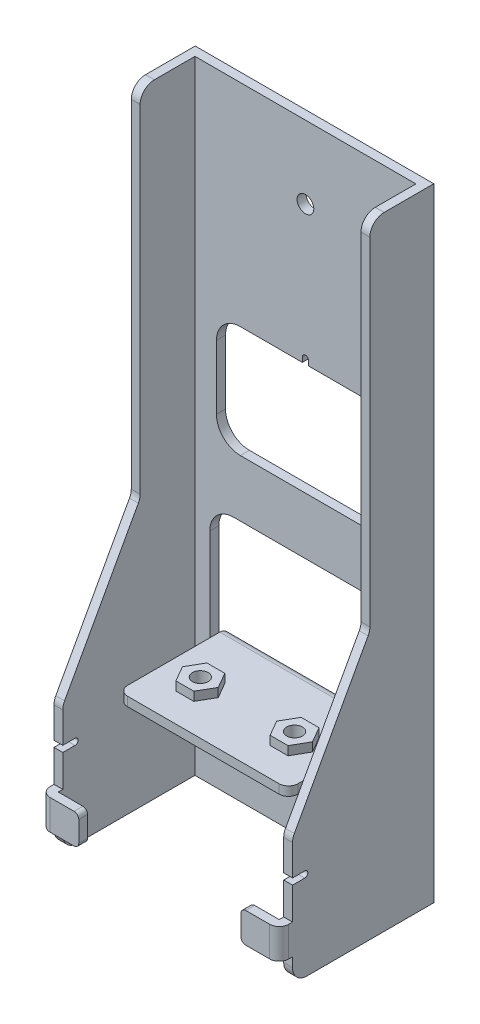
SolidWorks part; units mm, degrees
ref_plane "Plan de face" through (0, 0, 0) normal (0, 0, 1) x (1, 0, 0)
ref_plane "Plan de dessus" through (0, 0, 0) normal (0, 1, 0) x (1, 0, 0)
ref_plane "Plan de droite" through (0, 0, 0) normal (1, 0, 0) x (0, 0, -1)
sketch "Esquisse1" plane through (0, 0, 0) normal (0, 0, 1) x (1, 0, 0)
  line L0 (25, 0) -> (2.5, 0)
  line L1 (-25, 0) -> (-25, 130.5)
  line L2 (-25, 130.5) -> (25, 130.5)
  line L3 (25, 130.5) -> (25, 0)
  line L4 (-2.5, 2.8) -> (-2.5, 0)
  line L5 (2.5, 2.8) -> (2.5, 0)
  line L6 (-2.5, 0) -> (-25, 0)
  line L7 (-17.85, 26) -> (-17.85, 28.7)
  line L8 (-15.05, 50.9) -> (15.05, 50.9)
  line L9 (-20.05, 45.9) -> (-20.05, 26)
  line L10 (-17.85, 28.7) -> (17.85, 28.7)
  line L11 (20.05, 45.9) -> (20.05, 26)
  line L12 (-13.65, 86.2) -> (-0.65, 86.2)
  line L13 (-18.65, 81.2) -> (-18.65, 67.8)
  line L14 (-13.65, 62.8) -> (13.65, 62.8)
  line L15 (18.65, 81.2) -> (18.65, 67.8)
  line L16 (17.85, 26) -> (17.85, 28.7)
  line L17 (-0.65, 87.2) -> (-0.65, 86.2)
  line L18 (0.65, 87.2) -> (0.65, 86.2)
  line L19 (0.65, 86.2) -> (13.65, 86.2)
  arc A0 (2.5, 2.8) -> (-2.5, 2.8) centre (0, 2.8) ccw
  circle A1 centre (-18.05, 18.95) radius 1.75
  circle A2 centre (18.05, 18.95) radius 1.75
  arc A3 (-18.65, 67.8) -> (-13.65, 62.8) centre (-13.65, 67.8) ccw
  arc A4 (13.65, 62.8) -> (18.65, 67.8) centre (13.65, 67.8) ccw
  arc A5 (13.65, 86.2) -> (18.65, 81.2) centre (13.65, 81.2) cw
  arc A6 (-13.65, 86.2) -> (-18.65, 81.2) centre (-13.65, 81.2) ccw
  arc A7 (15.05, 50.9) -> (20.05, 45.9) centre (15.05, 45.9) cw
  arc A8 (-15.05, 50.9) -> (-20.05, 45.9) centre (-15.05, 45.9) ccw
  arc A9 (-20.05, 26) -> (-17.85, 26) centre (-18.95, 26) ccw
  arc A10 (17.85, 26) -> (20.05, 26) centre (18.95, 26) ccw
  arc A11 (0.65, 87.2) -> (-0.65, 87.2) centre (0, 87.2) ccw
  circle A12 centre (0, 115.25) radius 1.75
  dimension "D3" = 2.5
  dimension "D5" = 3.5
  dimension "D6" = 3.5
  dimension "D7" = 36.1
  dimension "D8" = 18.05
  dimension "D9" = 18.95
  dimension "D11" = 5
  dimension "D16" = 2.2
  dimension "D17" = 2.2
  dimension "D23" = 0.65
  dimension "D26" = 3.5
  dimension "D1" = 50
  dimension "D2" = 130.5
  dimension "D4" = 2.8
  dimension "D10" = 25
  dimension "D12" = 40.1
  dimension "D13" = 20.05
  dimension "D14" = 28.7
  dimension "D15" = 22.2
  dimension "D18" = 26
  dimension "D19" = 23.4
  dimension "D20" = 37.3
  dimension "D21" = 18.65
  dimension "D22" = 11.9
  dimension "D24" = 0.65
  dimension "D25" = 1
  dimension "D27" = 15.25
extrude "Boss.-Extru.1" add sketch "Esquisse1" along normal blind 1.9
sketch "Esquisse2" plane through (0, 0, 1.9) normal (0, 0, 1) x (1, 0, 0)
  line L0 (17.85, 28.7) -> (17.85, 26) construction
  line L1 (-17.85, 28.7) -> (17.85, 28.7)
  line L2 (-17.85, 28.7) -> (-17.85, 26.8)
  line L3 (-17.85, 26.8) -> (17.85, 26.8)
  line L4 (17.85, 28.7) -> (17.85, 26.8)
  dimension "D1" = 1.9
extrude "Boss.-Extru.2" add sketch "Esquisse2" along normal blind 21.4
fillet "Congé1" radius 2 2 edges at (17.85, 27.75, 23.3) (-17.85, 27.75, 23.3)
fillet "Congé2" radius 0.2 1 edges at (0, 26.8, 1.9)
fillet "Congé3" radius 2 1 edges at (0, 28.7, 0)
sketch "Esquisse3" plane through (0, 28.7, 0) normal (0, 1, 0) x (1, 0, 0)
  line L2 (6.1222, -14.05) -> (7.9986, -17.3)
  line L3 (7.9986, -17.3) -> (11.7514, -17.3)
  line L4 (11.7514, -17.3) -> (13.6278, -14.05)
  line L5 (13.6278, -14.05) -> (11.7514, -10.8)
  line L6 (11.7514, -10.8) -> (7.9986, -10.8)
  line L7 (7.9986, -10.8) -> (6.1222, -14.05)
  line L8 (-6.1222, -14.05) -> (-7.9986, -10.8)
  line L9 (-7.9986, -10.8) -> (-11.7514, -10.8)
  line L10 (-11.7514, -10.8) -> (-13.6278, -14.05)
  line L11 (-13.6278, -14.05) -> (-11.7514, -17.3)
  line L12 (-11.7514, -17.3) -> (-7.9986, -17.3)
  line L13 (-7.9986, -17.3) -> (-6.1222, -14.05)
  circle A0 centre (9.875, -14.05) radius 3.25 construction
  circle A1 centre (-9.875, -14.05) radius 3.25 construction
  dimension "D4" = 6.5
  dimension "D5" = 6.5
extrude "Boss.-Extru.3" add sketch "Esquisse3" along normal blind 1.85
hole_wizard "Trou taraudé M41" positions "Esquisse5" profile "Esquisse4" tap size "M4" standard "ISO"
sketch "Esquisse5" plane through (0, 30.55, 0) normal (0, 1, 0) x (-1, 0, 0)
  point P0 (-9.875, 14.05)
  point P1 (9.875, 14.05)
sketch "Esquisse4" plane through (9.875, 30.55, 14.05) normal (1, 0, 0) x (0, 0, 1)
  line L0 (0, 0) -> (0, 30.55)
  line L1 (0, 30.55) -> (1.65, 30.55)
  line L2 (1.65, 30.55) -> (1.65, 0)
  line L5 (1.65, 0) -> (0, 0)
  line L11 (0, -6.35) -> (0, 107.95) construction
  dimension "Diamètre du trou pour taraudage jusqu'au prochain" = 3.3
  dimension "Profondeur du trou pour taraudage jusqu'au prochain" = 30.55
sketch "Esquisse6" plane through (-25, 0, 0) normal (-1, 0, 0) x (0, 0, 1)
  line L0 (13.4, 130.5) -> (13.4, 56)
  line L1 (13.4, 56) -> (29.6, 26.5)
  line L2 (29.6, 26.5) -> (29.6, 19.3)
  line L3 (29.6, 19.3) -> (27.05, 19.3)
  line L4 (0, 130.5) -> (0, 0)
  line L5 (0, 0) -> (1.9, 0)
  line L6 (1.9, 0) -> (1.9, 130.5)
  line L7 (1.9, 130.5) -> (0, 130.5)
  line L8 (0, 130.5) -> (0, 0)
  line L9 (29.6, 11.3) -> (32.4, 11.3)
  line L10 (32.4, 11.3) -> (32.4, 5)
  line L11 (13.4, 130.5) -> (0, 130.5)
  line L12 (27.05, 18) -> (29.6, 18)
  line L13 (29.6, 18) -> (29.6, 11.3)
  line L14 (29.6, 0) -> (0, 0)
  line L15 (32.4, 5) -> (29.6, 5)
  line L16 (29.6, 5) -> (29.6, 0)
  arc A0 (27.05, 19.3) -> (27.05, 18) centre (27.05, 18.65) ccw
  dimension "D2" = 13.4
  dimension "D3" = 29.6
  dimension "D4" = 74.5
  dimension "D5" = 26.5
  dimension "D6" = 18
  dimension "D7" = 1.3
  dimension "D8" = 2.55
  dimension "D9" = 6.3
  dimension "D10" = 5
  dimension "D11" = 2.8
  dimension "D1" = 0
extrude "Boss.-Extru.4" add sketch "Esquisse6" against normal blind 1.85
fillet "Congé4" radius 3 4 edges at (-24.075, 26.5, 29.6) (-24.075, 56, 13.4) (-24.075, 130.5, 13.4) (-24.075, 0, 29.6)
sketch "Esquisse7" plane through (0, 0, 32.4) normal (0, 0, 1) x (1, 0, 0)
  line L0 (-23.15, 11.3) -> (-25, 11.3) construction
  line L1 (-25, 5) -> (-17, 5)
  line L2 (-25, 5) -> (-25, 11.3)
  line L3 (-25, 11.3) -> (-17, 11.3)
  line L4 (-17, 5) -> (-17, 11.3)
  dimension "D1" = 8
extrude "Boss.-Extru.5" add sketch "Esquisse7" against normal blind 1.85
fillet "Congé5" radius 1 2 edges at (-17, 11.3, 31.475) (-17, 5, 31.475)
fillet "Congé6" radius 2 1 edges at (-25, 8.15, 32.4)
mirror "Symétrie1" about plane through (0, 0, 0) normal (1, 0, 0) of "Boss.-Extru.4", "Congé4", "Boss.-Extru.5", "Congé5", "Congé6"
